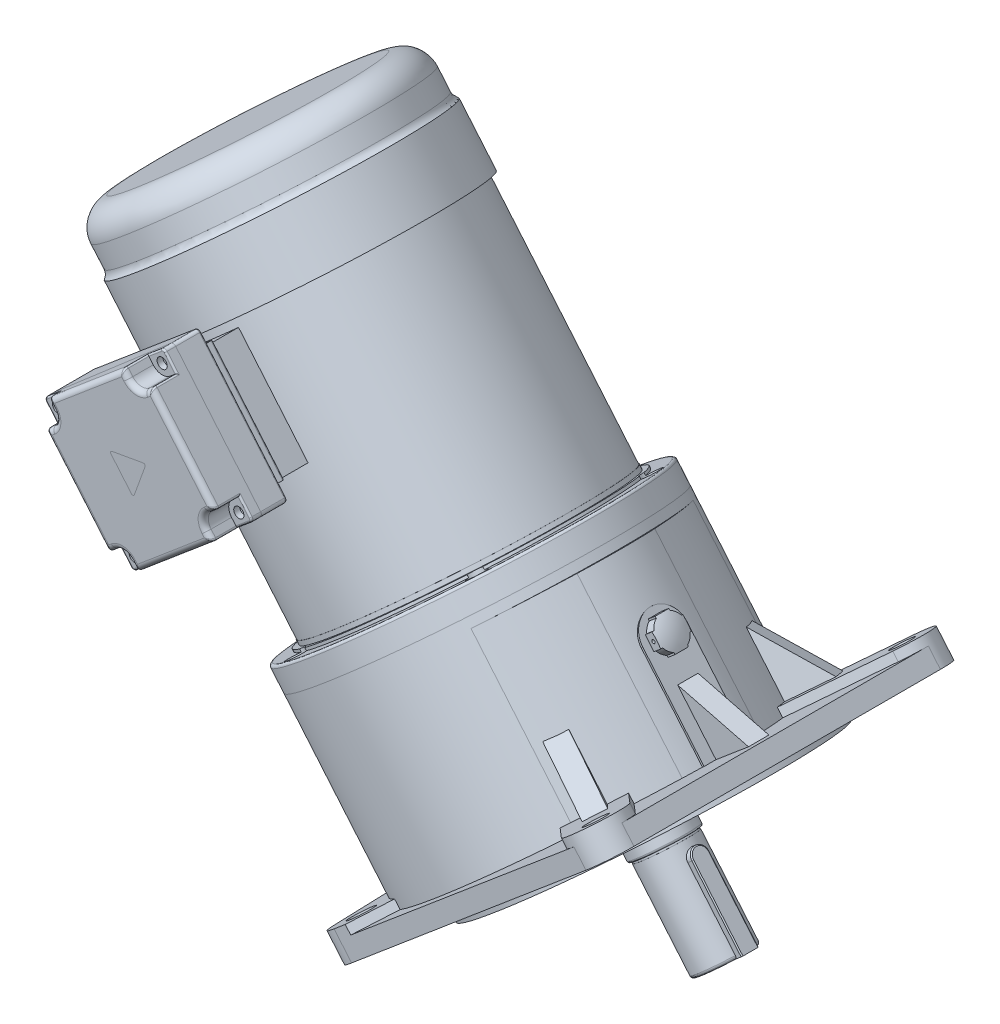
SolidWorks part; units mm, degrees
ref_plane "前视基准面" through (0, 0, 0) normal (0, 0, 1) x (1, 0, 0)
ref_plane "上视基准面" through (0, 0, 0) normal (0, 1, 0) x (1, 0, 0)
ref_plane "右视基准面" through (0, 0, 0) normal (1, 0, 0) x (0, 0, -1)
imported_body "接线盒座-1-surface1"
imported_body "接线盒座-1-surface2"
imported_body "接线盒座-1-surface3"
imported_body "接线盒座-1-surface4"
imported_body "接线盒座-1-surface5"
imported_body "接线盒盖-1-surface1"
imported_body "接线盒盖-1-surface2"
imported_body "接线盒盖-1-surface3"
imported_body "接线盒盖-1-surface4"
imported_body "接线盒盖-1-surface5"
imported_body "接线盒盖-1-surface6"
imported_body "接线盒盖-1-surface7"
imported_body "接线盒盖-1-surface8"
imported_body "32立式装配体2-1/16.06.23 32立式箱体(现用A)-1-surface1"
imported_body "32立式装配体2-1/15.12.26 32箱盖(新)-1-surface1"
imported_body "32立式装配体2-1/32 出轴-1-surface1"
imported_body "32立式装配体2-1/32 出轴-1-surface2"
imported_body "32立式装配体2-1/35X55X10油封-1-surface1"
imported_body "32立式装配体2-1/透气塞-1-surface1"
imported_body "32立式装配体2-1/C10X50-1-surface1"
sketch "草图1" plane through (28.2078, -33.4786, 0) normal (-0.6443, 0.7647, 0) x (0.7647, 0.6443, 0)
  circle A0 centre (-40.9074, 85.8443) radius 80
extrude "凸台-拉伸1" add sketch "草图1" along normal blind 136
sketch "草图2" plane through (-59.4225, 70.5258, 0) normal (-0.6443, 0.7647, 0) x (0.7647, 0.6443, 0)
  circle A0 centre (-40.9074, 85.8443) radius 83
extrude "凸台-拉伸2" add sketch "草图2" along normal blind 34
sketch "草图3" plane through (-81.3301, 96.5269, 0) normal (-0.6443, 0.7647, 0) x (0.7647, 0.6443, 0)
  circle A0 centre (-40.9074, 85.8443) radius 81
extrude "凸台-拉伸3" add sketch "草图3" along normal blind 31
fillet "圆角1" radius 5 1 edges at (-174.5574, 17.977, -85.8443)
fillet "圆角2" radius 15 1 edges at (-194.532, 41.6838, -85.8443)
